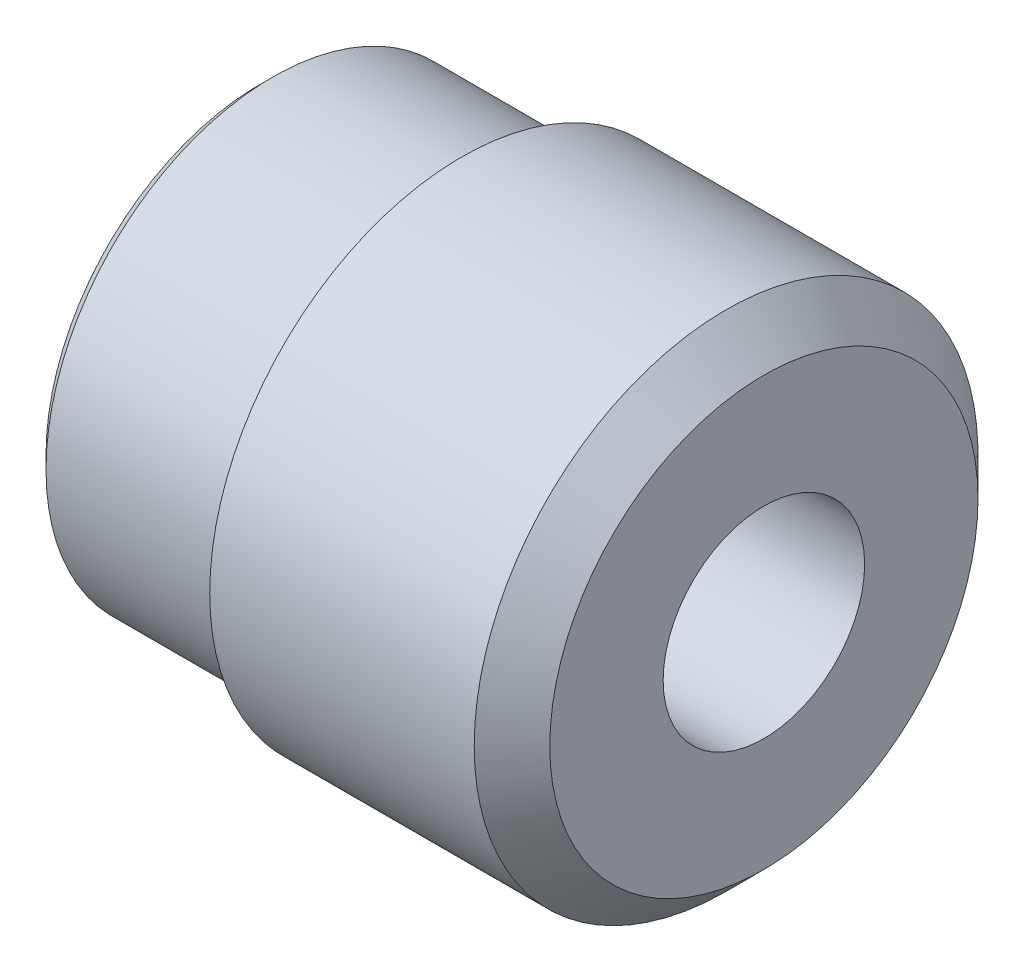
SolidWorks part; units mm, degrees
ref_plane "Face" through (0, 0, 0) normal (0, 0, 1) x (1, 0, 0)
ref_plane "Dessus" through (0, 0, 0) normal (0, 1, 0) x (1, 0, 0)
ref_plane "Droite" through (0, 0, 0) normal (1, 0, 0) x (0, 0, -1)
sketch "Esquisse1" plane through (0, 0, 0) normal (0, 0, 1) x (1, 0, 0)
  line L0 (-32.2385, 0) -> (46.5667, 0) construction
  line L1 (0, 6) -> (-14, 6)
  line L2 (-14, 6) -> (-14, 9)
  line L3 (-14, 9) -> (-6, 9)
  line L4 (-6, 9) -> (-6, 10)
  line L5 (-6, 10) -> (6, 10)
  line L6 (6, 10) -> (6, 4)
  line L7 (0, 6) -> (0, 4)
  line L8 (0, 4) -> (6, 4)
  dimension "D1" = 14
  dimension "D2" = 3
  dimension "D3" = 6
  dimension "D4" = 8
  dimension "D5" = 12
  dimension "D6" = 10
  dimension "D7" = 8
  dimension "D8" = 6
revolve "Base-Révolution" add sketch "Esquisse1" angle 360 about L0
chamfer "Chanfrein1" distance 1.5 angle 45
chamfer "Chanfrein2" distance 0.5 angle 45
